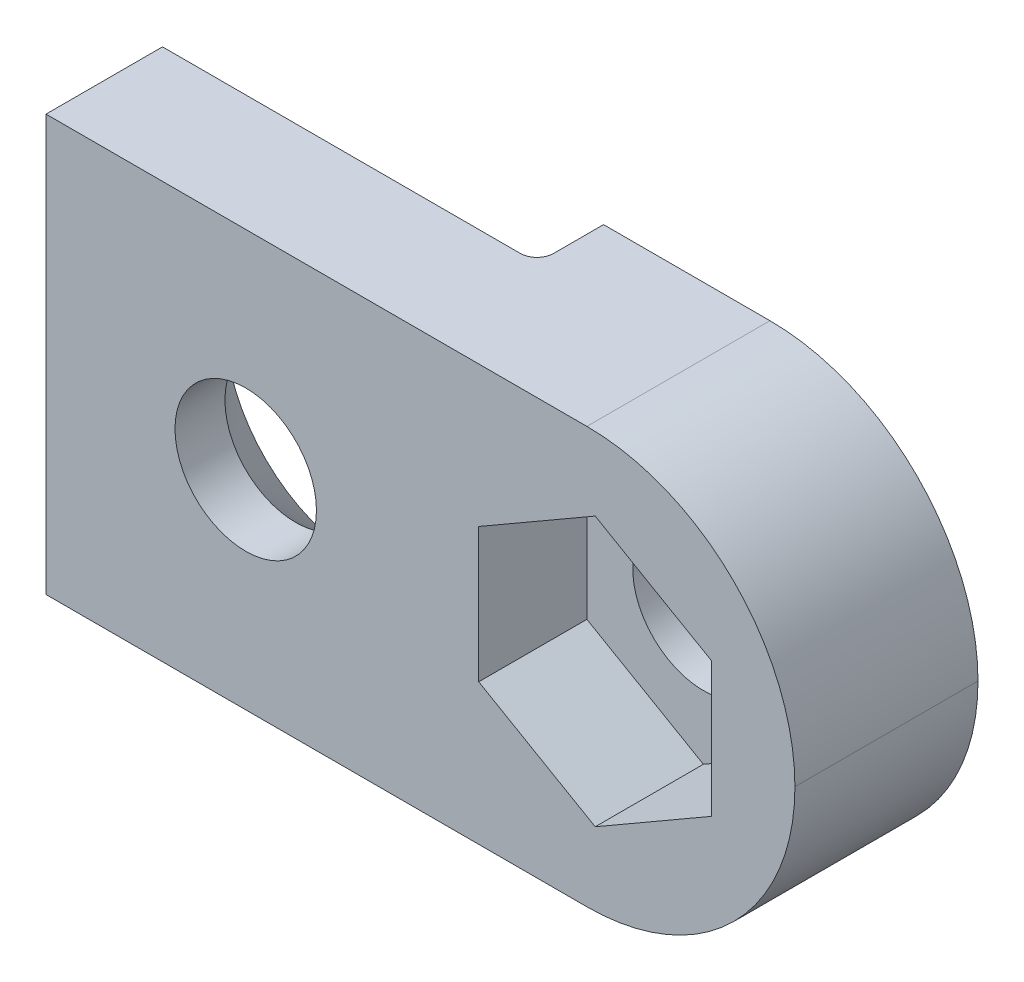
SolidWorks part; units mm, degrees
ref_plane "Front" through (0, 0, 0) normal (0, 0, 1) x (1, 0, 0)
ref_plane "Top" through (0, 0, 0) normal (0, 1, 0) x (1, 0, 0)
ref_plane "Right" through (0, 0, 0) normal (1, 0, 0) x (0, 0, -1)
sketch "Sketch1" plane through (0, 0, 0) normal (0, 0, 1) x (1, 0, 0)
  line L1 (-13.4927, 3.9252) -> (4.5073, 3.9252)
  line L2 (-13.4927, 3.9252) -> (-13.4927, -6.0748)
  line L3 (-13.4927, -6.0748) -> (4.5073, -6.0748)
  line L4 (4.5073, 3.9252) -> (4.5073, -6.0748)
  line L5 (2.5073, -2.6914) -> (2.5073, 0.5418)
  line L6 (2.5073, 0.5418) -> (-0.2927, 2.1583)
  line L7 (-0.2927, 2.1583) -> (-3.0927, 0.5418)
  line L8 (-3.0927, 0.5418) -> (-3.0927, -2.6914)
  line L9 (-3.0927, -2.6914) -> (-0.2927, -4.308)
  line L10 (-0.2927, -4.308) -> (2.5073, -2.6914)
  circle A0 centre (-8.6927, -1.0748) radius 1.7
  circle A1 centre (-0.2927, -1.0748) radius 2.8 construction
  point P7 (-0.2927, -1.0748)
  point P15 (0, 0)
  dimension "D2" = 5.6
  dimension "D7" = 3.4
  dimension "D1" = 4.8
  dimension "D3" = 10
  dimension "D4" = 8.4
  dimension "D5" = 4.8
  dimension "D6" = 5
extrude "Boss-Extrude1" add sketch "Sketch1" along normal blind 4.4
fillet "Fillet1" radius 5 2 edges at (4.5073, -6.0748, 2.2) (4.5073, 3.9252, 2.2)
sketch "Sketch5" plane through (0, 0, 0) normal (0, 0, 1) x (1, 0, 0)
  line L1 (-0.2927, 2.1583) -> (-3.0927, 0.5418)
  line L2 (-3.0927, 0.5418) -> (-3.0927, -2.6914)
  line L3 (-3.0927, -2.6914) -> (-0.2927, -4.308)
  line L4 (-0.2927, -4.308) -> (2.5073, -2.6914)
  line L5 (2.5073, -2.6914) -> (2.5073, 0.5418)
  line L6 (2.5073, 0.5418) -> (-0.2927, 2.1583)
  circle A0 centre (-0.2927, -1.0748) radius 2.8 construction
  circle A1 centre (-0.2927, -1.0748) radius 1.7
  dimension "D1" = 3.4
  dimension "D2" = 5.6
extrude "Boss-Extrude2" add sketch "Sketch5" along normal blind 1.8
sketch "Sketch6" plane through (0, 0, 0) normal (0, 0, 1) x (1, 0, 0)
  line L0 (-13.4927, -6.0748) -> (-0.4927, -6.0748) construction
  line L1 (-13.4927, 3.9252) -> (-4.4927, 3.9252)
  line L2 (-13.4927, 3.9252) -> (-13.4927, -6.0748)
  line L3 (-13.4927, -6.0748) -> (-4.4927, -6.0748)
  line L4 (-4.4927, 3.9252) -> (-4.4927, -6.0748)
  dimension "D1" = 9
extrude "Cut-Extrude1" cut sketch "Sketch6" along normal blind 1.6
hole_wizard "CSK for M3 Flat Head Machine Screw2" positions "Sketch7" profile "Sketch8" countersink size "M3" standard "ANSI Metric"
sketch "Sketch7" plane through (0, 0, 1.6) normal (0, 0, -1) x (-1, 0, 0)
  point P0 (8.6927, -1.0748)
sketch "Sketch8" plane through (-8.6927, -1.0748, 1.6) normal (1, 0, 0) x (0, 1, 0)
  line L0 (0, 0) -> (0, 4.0215)
  line L1 (0, 4.0215) -> (1.7, 3)
  line L2 (1.7, 3) -> (1.7, 1.6)
  line L3 (1.7, 1.6) -> (3.3, 0)
  line L5 (3.3, 0) -> (0, 0)
  line L6 (-1.7, 1.6) -> (-3.3, 0) construction
  line L10 (0, 4.0215) -> (-1.7, 3) construction
  line L11 (0, -6.35) -> (0, 107.95) construction
  dimension "Hole Dia." = 3.4
  dimension "Hole Depth" = 3
  dimension "Near C'Sink Dia." = 6.6
  dimension "Near C'Sink Angle" = 90
  dimension "Drill Angle" = 118
fillet "Fillet2" radius 0.4 1 edges at (-4.4927, -1.0748, 1.6)
